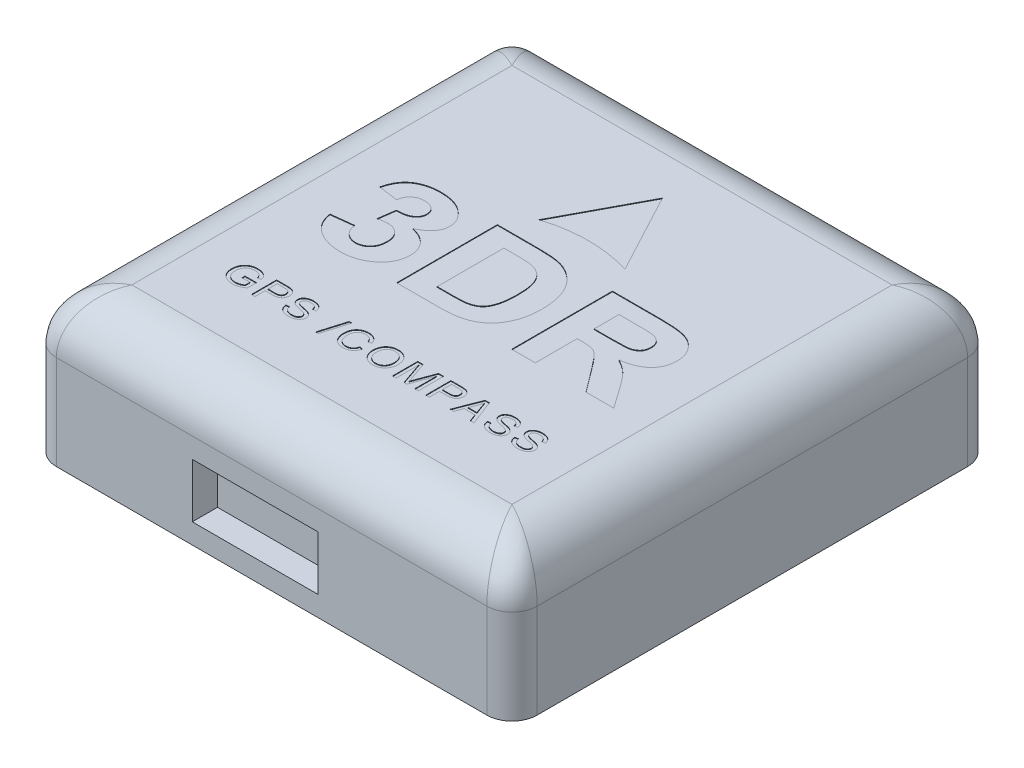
SolidWorks part; units mm, degrees
ref_plane "Front Plane" through (0, 0, 0) normal (0, 0, 1) x (1, 0, 0)
ref_plane "Top Plane" through (0, 0, 0) normal (0, 1, 0) x (1, 0, 0)
ref_plane "Right Plane" through (0, 0, 0) normal (1, 0, 0) x (0, 0, -1)
sketch "Sketch1" plane through (0, 0, 0) normal (0, 1, 0) x (1, 0, 0)
  line L1 (-19.1, 19.1) -> (19.1, 19.1)
  line L2 (-19.1, 19.1) -> (-19.1, -19.1)
  line L3 (-19.1, -19.1) -> (19.1, -19.1)
  line L4 (19.1, 19.1) -> (19.1, -19.1)
  line L5 (-19.1, 19.1) -> (19.1, -19.1) construction
  line L6 (-19.1, -19.1) -> (19.1, 19.1) construction
  point P0 (0, 0)
  dimension "D1" = 38.2
extrude "Boss-Extrude1" add sketch "Sketch1" along normal blind 11.5
sketch "ref" plane through (0, 0, 19.1) normal (0, 0, 1) x (1, 0, 0)
  line L0 (19.1, 0) -> (19.1, 7.5) construction
  line L2 (19.1, 11.5) -> (19.1, 0) construction
  dimension "D1" = 7.5
fillet "Fillet1" radius 4 4 edges at (0, 11.5, 19.1) (-19.1, 11.5, 0) (0, 11.5, -19.1) (19.1, 11.5, 0)
fillet "Fillet2" radius 2 8 edges at (19.1, 3.75, 19.1) (-19.1, 3.75, 19.1) (-19.1, 3.75, -19.1) (19.1, 3.75, -19.1) (17.9284, 10.3284, 17.9284) (-17.9284, 10.3284, 17.9284) (-17.9284, 10.3284, -17.9284) (17.9284, 10.3284, -17.9284)
hole_wizard "CBORE for M2 SHCS1" positions "Sketch3" profile "Sketch5" counterbore size "M2" standard "ANSI Metric"
sketch "Sketch3" plane through (0, 0, 0) normal (0, -1, 0) x (-1, 0, 0)
  line L1 (-15, 15) -> (15, 15) construction
  line L2 (-15, 15) -> (-15, -15) construction
  line L3 (-15, -15) -> (15, -15) construction
  line L4 (15, 15) -> (15, -15) construction
  line L5 (-15, 15) -> (15, -15) construction
  line L6 (-15, -15) -> (15, 15) construction
  point P2 (15, -15)
  point P193 (-15, 15)
  point P194 (-15, -15)
  point P195 (15, 15)
  dimension "D1" = 30
sketch "Sketch5" plane through (-15, 0, 15) normal (1, 0, 0) x (0, 0, -1)
  line L0 (0, 0) -> (0, 4.6609)
  line L1 (0, 4.6609) -> (1.1, 4)
  line L2 (1.1, 4) -> (1.1, 1.5)
  line L3 (1.1, 1.5) -> (1.8, 1.5)
  line L4 (1.8, 1.5) -> (1.8, 0)
  line L5 (1.8, 0) -> (0, 0)
  line L10 (0, 4.6609) -> (-1.1, 4) construction
  line L11 (0, -6.35) -> (0, 107.95) construction
  dimension "Hole Dia." = 2.2
  dimension "Hole Depth" = 4
  dimension "C'Bore Dia." = 3.6
  dimension "C'Bore Depth" = 1.5
  dimension "Drill Angle" = 118
sketch "Sketch6" plane through (0, 11.5, 0) normal (0, 1, 0) x (1, 0, 0)
  line L0 (-15.1, -11.0075) -> (15.1, -11.0075) construction
  line L1 (-15.1, 15.1) -> (-15.1, -15.1) construction
  line L2 (15.1, -15.1) -> (15.1, 15.1) construction
  line L3 (-15.1, -4.4355) -> (15.1, -4.4355) construction
  line L4 (0, 15.1) -> (0, 6.3019) construction
  line L5 (15.1, 15.1) -> (-15.1, 15.1) construction
  line L6 (0, 11.9532) -> (-3.4156, 5.5537)
  line L7 (0, 11.9532) -> (3.4156, 5.5537)
  arc A0 (-3.4156, 5.5537) -> (3.4156, 5.5537) centre (0, -5.154) cw
  text T0 "GPS /COMPASS" font "Arial Narrow" height 2
  text T1 "3DR" font "Arial Narrow" height 8
  point P18 (0, 0)
  point P19 (-3.4156, 5.5537)
extrude "Cut-Extrude1" cut sketch "Sketch6" against normal blind 0.05
sketch "Sketch7" plane through (0, 0, 19.1) normal (0, 0, 1) x (1, 0, 0)
  line L0 (-19.1, 0) -> (-19.1, 7.5) construction
  line L1 (-6.3, 1.6) -> (3.7, 1.6)
  line L2 (-6.3, 1.6) -> (-6.3, 5.9)
  line L3 (-6.3, 5.9) -> (3.7, 5.9)
  line L4 (3.7, 1.6) -> (3.7, 5.9)
  line L5 (-17.1, 0) -> (17.1, 0) construction
  dimension "D1" = 12.8
  dimension "D2" = 10
  dimension "D3" = 1.6
  dimension "D4" = 4.3
extrude "Cut-Extrude2" cut sketch "Sketch7" against normal blind 2
